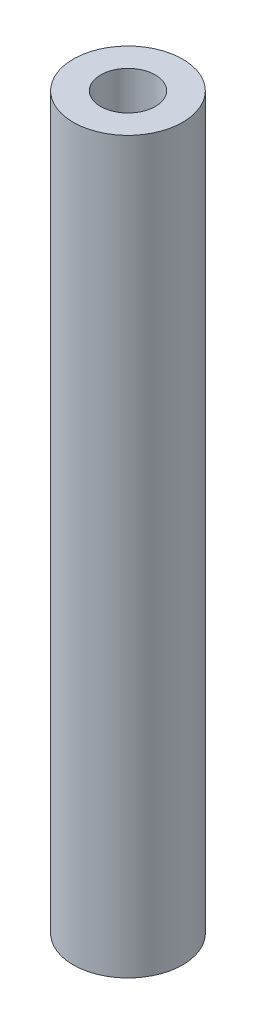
SolidWorks part; units mm, degrees
ref_plane "Front Plane" through (0, 0, 0) normal (0, 0, 1) x (1, 0, 0)
ref_plane "Top Plane" through (0, 0, 0) normal (0, 1, 0) x (1, 0, 0)
ref_plane "Right Plane" through (0, 0, 0) normal (1, 0, 0) x (0, 0, -1)
sketch "Sketch1" plane through (0, 0, 0) normal (0, 1, 0) x (1, 0, 0)
  circle A0 centre (0, 0) radius 3
  dimension "D1" = 6
extrude "Extrude1" add sketch "Sketch1" along normal blind 40
sketch "Sketch2" plane through (0, 40, 0) normal (0, 1, 0) x (1, 0, 0)
  circle A0 centre (0, 0) radius 1.5
  dimension "D1" = 3
extrude "Extrude2" cut sketch "Sketch2" against normal blind 3.5
sketch "Sketch3" plane through (0, 0, 0) normal (0, -1, 0) x (1, 0, 0)
  circle A0 centre (0, 0) radius 1.5
  dimension "D1" = 3
extrude "Extrude3" cut sketch "Sketch3" against normal blind 4.5
